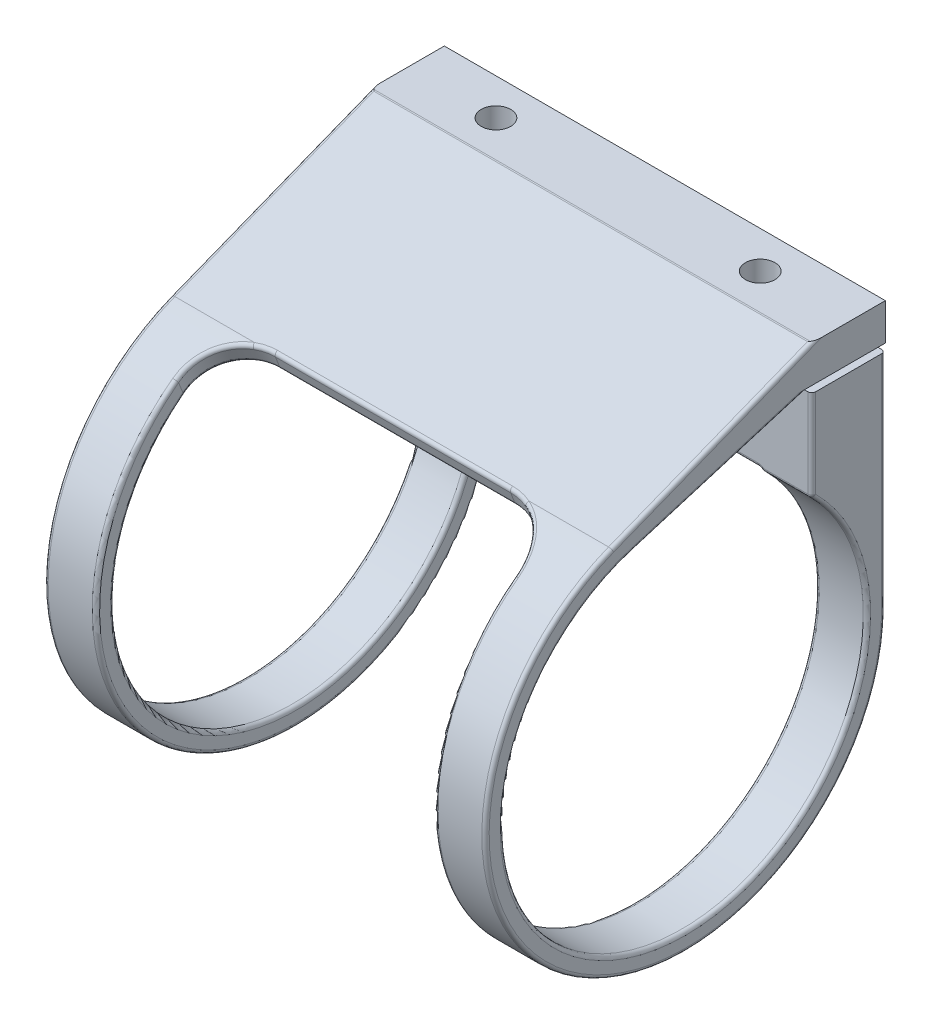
SolidWorks part; units mm, degrees
ref_plane "Front Plane" through (0, 0, 0) normal (0, 0, 1) x (1, 0, 0)
ref_plane "Top Plane" through (0, 0, 0) normal (0, 1, 0) x (1, 0, 0)
ref_plane "Right Plane" through (0, 0, 0) normal (1, 0, 0) x (0, 0, -1)
sketch "Sketch1" plane through (0, 0, 0) normal (1, 0, 0) x (0, 0, -1)
  line L0 (34.544, 45.72) -> (21.844, 45.72)
  line L1 (34.544, 45.72) -> (34.544, 39.37)
  line L2 (34.544, 38.1) -> (21.844, 38.1)
  line L3 (21.844, 45.72) -> (-12.6507, 32.1442)
  line L5 (34.544, 39.37) -> (21.844, 39.37)
  line L6 (21.844, 38.1) -> (21.844, 22.5134)
  line L7 (21.844, 39.37) -> (-9.0732, 30.0282)
  line L8 (34.544, 38.1) -> (34.544, 0)
  arc A0 (-12.6507, 32.1442) -> (34.544, 0) centre (0, 0) ccw
  arc A1 (-9.0732, 30.0282) -> (21.844, 22.5134) centre (0, 0) ccw
  dimension "D1" = 62.738
  dimension "D6" = 12.7
  dimension "D5" = 1.27
  dimension "D2" = 3.175
  dimension "D3" = 45.72
  dimension "D4" = 6.35
extrude "Boss-Extrude1" add sketch "Sketch1" along normal mid plane 76.2
ref_plane "Plane1" through (0, 0, 0) normal (0, 0.3662, -0.9305) x (-1, 0, 0)
ref_plane "Plane2" through (0, 0, -28.194) normal (0, 0, 1) x (1, 0, 0)
sketch "Sketch26" plane through (0, 0, 0) normal (0, 0.3662, -0.9305) x (-1, 0, 0)
  line L9 (75.3774, 0) -> (-21.3436, 0) construction
  line L10 (-38.1, 0) -> (38.1, 0) construction
  line L13 (29.21, 53.7773) -> (-29.21, 53.7773)
  line L14 (29.21, 53.7773) -> (29.21, 6.2206)
  line L16 (29.21, 6.2206) -> (-29.21, 6.2206)
  line L17 (-29.21, 53.7773) -> (-29.21, 6.2206)
  line L18 (0, 0) -> (0, 6.2206) construction
  line L19 (38.1, -34.544) -> (38.1, 34.544) construction
  dimension "D1" = 8.89
revolve "Cut-Revolve2" cut sketch "Sketch26" angle 260 about L9
hole_wizard "#7 (0.201) Diameter Hole1" positions "Sketch28" profile "Sketch27" hole size "#7" standard "ANSI Inch"
sketch "Sketch28" plane through (0, 45.72, 0) normal (0, -1, 0) x (-1, 0, 0)
  line L2 (-22.881, 28.1418) -> (22.881, 28.2438) construction
  line L3 (0, 0) -> (0, 28.1928) construction
  circle A6 centre (-0.2564, 143.2233) radius 117.2843 construction
  point P26 (22.881, 28.2438)
  point P28 (-22.881, 28.1418)
  dimension "D1" = 45.7621
sketch "Sketch27" plane through (-22.881, 45.72, -28.2438) normal (1, 0, 0) x (0, 0, 1)
  line L0 (0, 0) -> (0, 6.35)
  line L1 (0, 6.35) -> (2.5527, 6.35)
  line L2 (2.5527, 6.35) -> (2.5527, 0)
  line L5 (2.5527, 0) -> (0, 0)
  line L11 (0, -6.35) -> (0, 107.95) construction
  dimension "Thru Hole Dia." = 5.1054
  dimension "Thru Hole Depth" = 6.35
sketch "Sketch29" plane through (0, 0, -21.844) normal (0, 0, 1) x (1, 0, 0)
  line L0 (38.1, 22.5134) -> (-38.1, 22.5134) construction
  line L1 (-29.21, 22.5134) -> (29.21, 22.5134)
  line L2 (-29.21, 22.5134) -> (-29.21, 6.2447)
  line L3 (-29.21, 6.2447) -> (29.21, 6.2447)
  line L4 (29.21, 22.5134) -> (29.21, 6.2447)
  line L5 (0, 45.72) -> (0, 22.5134) construction
  line L6 (38.1, 45.72) -> (-38.1, 45.72) construction
  line L7 (-29.21, -31.369) -> (-29.21, 29.1897) construction
  line L8 (-29.21, 6.2447) -> (29.21, 6.2447) construction
extrude "Cut-Extrude11" cut sketch "Sketch29" against normal blind 12.7
hole_wizard "1/4-20 Tapped Hole1" positions "Sketch34" profile "Sketch33" tap size "1/4-20" standard "ANSI Inch"
sketch "Sketch34" plane through (0, 22.5134, 0) normal (0, 1, 0) x (1, 0, 0)
  circle A0 centre (-22.881, 28.2438) radius 2.5527 construction
  circle A1 centre (22.881, 28.1418) radius 2.5527 construction
  point P0 (-22.881, 28.2438)
  point P3 (22.881, 28.1418)
sketch "Sketch33" plane through (-22.881, 22.5134, -28.2438) normal (1, 0, 0) x (0, 0, -1)
  line L0 (0, 0) -> (0, 17.2818)
  line L1 (0, 17.2818) -> (2.5527, 15.748)
  line L2 (2.5527, 15.748) -> (2.5527, 0)
  line L5 (2.5527, 0) -> (0, 0)
  line L10 (0, 17.2818) -> (-2.5527, 15.748) construction
  line L11 (0, -6.35) -> (0, 107.95) construction
  dimension "Tap Drill Dia." = 5.1054
  dimension "Tap Drill Depth" = 15.748
  dimension "Drill Angle" = 118
fillet "Fillet8" radius 8.89 2 edges at (-29.21, 30.6669, 12.0694) (29.21, 30.6669, 12.0694)
fillet "Fillet9" radius 0.635 25 edges at (29.21, 11.2567, -34.544) (29.21, -30.8329, 15.5762) (25.8705, 31.3806, 14.4412) (38.1, -30.4815, 7.4089) (0, 32.1442, 12.6507) (-27.3267, 30.7345, 15.7696) (-29.21, -30.8329, 15.5762) (-29.21, -31.3233, 1.6935) (-25.8699, 28.4212, 13.2759) (0, 29.1897, 11.488) (27.3407, 27.7555, 14.6166) (-38.1, 34.6991, -6.3854) (-38.1, 38.9321, -4.5966) (-38.1, -28.5508, 19.4458) (38.1, 38.9321, -4.5966) (38.1, -28.5508, 19.4458) (38.1, 30.3067, -21.844) (-38.1, 30.3067, -21.844) (38.1, 34.6991, -6.3854) (0, 45.72, -21.844) (-29.21, 11.2567, -34.544) (29.21, -31.3233, 1.6935) (-38.1, -30.4815, 7.4089) (-38.1, 19.05, -34.544) (38.1, 19.05, -34.544)
fillet "Fillet14" radius 0.635 6 edges at (-29.396, 22.5134, -34.358) (-29.5357, 22.5134, -21.9593) (29.396, 22.5134, -34.358) (29.4177, 22.5134, -22.0807) (-29.21, 22.5134, -28.3277) (29.21, 22.5134, -28.3277)
fillet "Fillet15" radius 0.635 10 edges at (37.8383, 22.5647, -21.9653) (33.9829, 22.5134, -21.844) (30.3165, 22.5037, -21.844) (-37.8383, 22.5647, -21.9653) (-33.9829, 22.5134, -21.844) (-29.3735, 22.5037, -21.844) (29.0626, 22.4567, -34.544) (-29.0626, 22.4567, -34.544) (0, 22.5134, -21.844) (0, 22.5134, -34.544)
